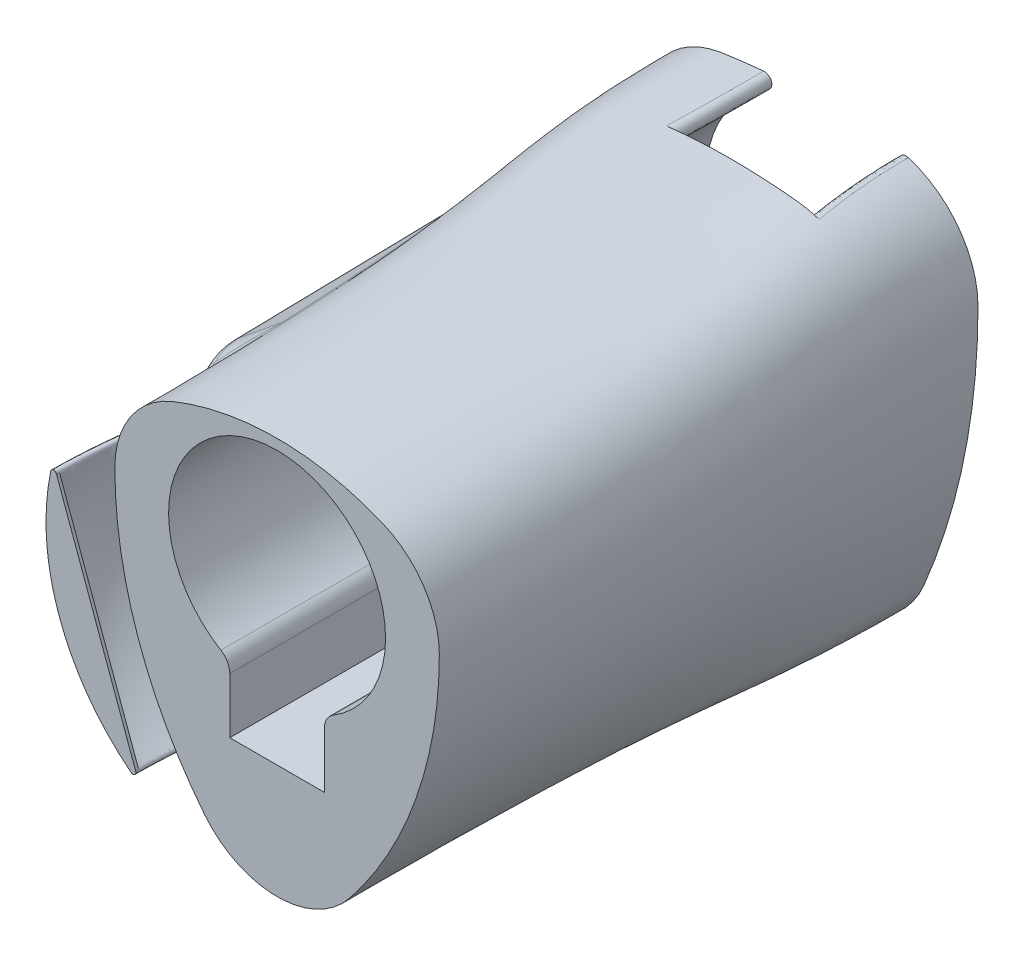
SolidWorks part; units mm, degrees
ref_plane "Front Plane" through (0, 0, 0) normal (0, 0, 1) x (1, 0, 0)
ref_plane "Top Plane" through (0, 0, 0) normal (0, 1, 0) x (1, 0, 0)
ref_plane "Right Plane" through (0, 0, 0) normal (1, 0, 0) x (0, 0, -1)
sketch "Sketch1" plane through (0, 0, 0) normal (0, 0, 1) x (1, 0, 0)
  line L0 (-25.4, 3.7252) -> (19.05, 3.7252) construction
  arc A0 (-9.1579, -36.6222) -> (11.711, -32.7366) centre (0, -27.8232) ccw construction
  arc A1 (11.711, -32.7366) -> (19.05, 3.7252) centre (-75.1948, 3.7252) ccw construction
  arc A2 (-9.1579, -36.6222) -> (-25.4, 3.7252) centre (32.8349, 3.7252) cw construction
  arc A3 (-25.4, 3.7252) -> (-15.285, 15.4959) centre (-13.4938, 3.7252) cw construction
  arc A4 (19.05, 3.7252) -> (7.2571, 16.3927) centre (6.35, 3.7252) ccw construction
  arc A5 (-15.285, 15.4959) -> (7.2571, 16.3927) centre (0, -84.9478) cw construction
  circle A6 centre (0, 0) radius 14.605 construction
  arc A7 (-26.162, 3.7252) -> (-15.3996, 16.2492) centre (-13.4938, 3.7252) cw
  arc A8 (-15.3996, 16.2492) -> (7.3116, 17.1528) centre (0, -84.9478) cw
  arc A9 (19.812, 3.7252) -> (7.3116, 17.1528) centre (6.35, 3.7252) ccw
  arc A10 (12.4137, -33.0314) -> (19.812, 3.7252) centre (-75.1948, 3.7252) ccw
  arc A11 (-9.7074, -37.1501) -> (12.4137, -33.0314) centre (0, -27.8232) ccw
  arc A12 (-9.7074, -37.1501) -> (-26.162, 3.7252) centre (32.8349, 3.7252) cw
  dimension "D1" = 101.6
  dimension "D2" = 12.7
  dimension "D6" = 12.7
  dimension "D7" = 29.21
  dimension "D3" = 25.4
  dimension "D4" = 19.05
  dimension "D5" = 57.1246
  dimension "D8" = 84.9478
  dimension "D9" = 0.762
ref_plane "End Plane" through (0, 0, 76.2) normal (0, 0, 1) x (1, 0, 0)
sketch "Sketch4" plane through (0, 0, 76.2) normal (0, 0, 1) x (1, 0, 0)
  line L0 (0, 16.1695) -> (0, -8.8103) construction
  line L1 (-22.225, 1.7278) -> (-22.225, 11.2362) construction
  arc A0 (-14.2875, 13.501) -> (14.2875, 13.501) centre (0, -21.8186) cw
  arc A1 (-14.2875, 13.501) -> (-22.225, 1.7278) centre (-9.525, 1.7278) ccw
  arc A2 (14.2875, 13.501) -> (22.225, 1.7278) centre (9.525, 1.7278) cw
  arc A3 (-22.225, 1.7278) -> (-9.9123, -33.3395) centre (33.8684, 1.7278) ccw
  arc A4 (22.225, 1.7278) -> (9.9123, -33.3395) centre (-33.8684, 1.7278) cw
  circle A6 centre (0, 0) radius 14.605 construction
  arc A7 (-9.9123, -33.3395) -> (9.9123, -33.3395) centre (0, -25.4) ccw
  point P12 (0, 16.2814)
  point P33 (0, 14.605)
  dimension "D1" = 12.7
  dimension "D3" = 38.1
  dimension "D2" = 1.6764
  dimension "D4" = 44.45
  dimension "D5" = 25.4
loft "Loft4" add profiles "Sketch1", "Sketch4"
ref_plane "Plane4" through (0, 0, 38.1) normal (0, 0, 1) x (1, 0, 0)
sketch "Sketch10" plane through (0, 0, 38.1) normal (0, 0, 1) x (1, 0, 0)
  line L0 (-19.1984, 0.9476) -> (-8.3393, -28.8876) construction
  line L1 (-17.7066, 1.4906) -> (-6.8475, -28.3447)
  line L2 (-20.6902, 0.4047) -> (-9.831, -29.4306)
  line L3 (-15.1563, -5.5164) -> (-13.7242, -4.9952) construction
  line L4 (-25.4, 3.7252) -> (19.05, 3.7252) construction
  arc A0 (-17.7066, 1.4906) -> (-20.6902, 0.4047) centre (-19.1984, 0.9476) ccw
  arc A1 (-9.831, -29.4306) -> (-6.8475, -28.3447) centre (-8.3393, -28.8876) ccw
  circle A2 centre (0, 0) radius 14.605 construction
  spline S0 degree 3 number of poles 127 (-14.6039, 14.283) -> (-14.6039, 14.283)
  spline S1 degree 3 number of poles 127 (-14.6039, 14.283) -> (-14.6039, 14.283) construction
  point P3 (-13.7688, -13.97)
  dimension "D1" = 31.75
  dimension "D2" = 3.175
  dimension "D3" = 1.524
  dimension "D4" = 70
  dimension "D5" = 13.97
ref_plane "Plane5" through (-13.7688, -13.97, 38.1) normal (0.342, -0.9397, 0) x (-0.9397, -0.342, 0)
sketch "Sketch11" plane through (-13.7688, -13.97, 38.1) normal (0.342, -0.9397, 0) x (-0.9397, -0.342, 0)
  circle A0 centre (25.4, 0) radius 25.4
  dimension "D1" = 50.8
ref_plane "Plane6" through (-19.3665, -7.0488, 0.7197) normal (-0.9391, -0.3418, 0.0349) x (0.342, -0.9397, 0)
ref_plane "Plane7" through (-25.8069, -9.393, 0.959) normal (-0.9391, -0.3418, 0.0349) x (0.342, -0.9397, 0)
sketch "Sketch13" plane through (-25.8069, -9.393, 0.959) normal (-0.9391, -0.3418, 0.0349) x (0.342, -0.9397, 0)
  line L1 (-6.1867, 61.5885) -> (23.0233, 61.5885)
  line L2 (-12.5367, 55.2385) -> (-12.5367, 17.1385)
  line L3 (-6.1867, 10.7885) -> (23.0233, 10.7885)
  line L4 (29.3733, 55.2385) -> (29.3733, 17.1385)
  line L5 (-7.4567, 37.4585) -> (24.2933, 37.4585) construction
  arc A0 (-6.1867, 10.7885) -> (-12.5367, 17.1385) centre (-6.1867, 17.1385) cw
  arc A1 (23.0233, 10.7885) -> (29.3733, 17.1385) centre (23.0233, 17.1385) ccw
  arc A2 (23.0233, 61.5885) -> (29.3733, 55.2385) centre (23.0233, 55.2385) cw
  arc A3 (-6.1867, 61.5885) -> (-12.5367, 55.2385) centre (-6.1867, 55.2385) ccw
  point P4 (-12.5367, 36.1885)
  point P13 (-12.5367, 10.7885)
  point P20 (-12.5367, 61.5885)
  dimension "D4" = 6.35
  dimension "D1" = 5.08
  dimension "D2" = 5.08
  dimension "D3" = 50.8
  dimension "D5" = 1.27
extrude "Boss-Extrude3" add sketch "Sketch13" against normal up to body draft 19 separate body
sweep "Cut-Sweep3" cut profiles "Sketch10" path "Sketch11"
fillet "Fillet17" radius 12.7 6 edges at (-10.7208, -35.6171, 13.6969) (-8.2115, -36.5143, 31.5173) (-9.7964, -33.5869, 62.0175) (-20.1117, 9.0919, 58.7027) (-23.2951, 7.4937, 28.1965) (-25.785, 2.4872, 12.1847)
fillet "Fillet21" radius 5.08 10 edges at (-15.2653, -36.7168, 17.0115) (-16.2873, -34.3283, 12.9041) (-22.5739, -17.1748, 11.741) (-28.7699, -0.0358, 12.8729) (-29.5351, 2.4836, 16.9579) (-28.908, 2.8197, 37.1255) (-26.7707, -0.5124, 62.0027) (-20.9079, -16.5684, 62.51) (-14.873, -33.2327, 61.6921) (-14.5739, -36.5629, 37.1255)
fillet "Fillet20" radius 1.27 22 edges at (-15.8496, -30.8952, 58.3065) (-27.9738, -1.4431, 20.5133) (-15.7866, -33.1523, 37.8953) (-28.3227, -0.6847, 18.5318) (-26.8505, -0.6949, 57.9618) (-27.0504, -0.2588, 56.8667) (-15.1462, -32.9324, 57.2088) (-22.4173, -17.1178, 16.513) (-28.0929, -1.5001, 16.7498) (-22.2772, -17.0668, 20.7837) (-17.4666, -30.5414, 18.26) (-21.0394, -16.6163, 58.5046) (-26.8814, -0.9677, 54.5637) (-21.1795, -16.6673, 54.234) (-15.4168, -32.0786, 58.3646)
sketch "Sketch16" plane through (0, 0, 0) normal (0, 0, -1) x (-1, 0, 0)
  line L0 (-6.477, -14.8802) -> (-6.477, -22.479)
  line L1 (-6.477, -22.479) -> (6.477, -22.479)
  line L2 (6.477, -22.479) -> (6.477, -14.8802)
  line L3 (0, -22.479) -> (0, 0) construction
  arc A0 (7.7006, -12.7079) -> (-7.7006, -12.7079) centre (0, 0) ccw
  arc A1 (6.477, -14.8802) -> (7.7006, -12.7079) centre (9.017, -14.8802) cw
  arc A2 (-6.477, -14.8802) -> (-7.7006, -12.7079) centre (-9.017, -14.8802) ccw
  dimension "D1" = 2.54
  dimension "D2" = 14.859
  dimension "D3" = 12.954
  dimension "D4" = 37.084
extrude "Cut-Extrude3" cut sketch "Sketch16" against normal through all
sketch "Sketch17" plane through (0, 0, 0) normal (0, 0, -1) x (-1, 0, 0)
  circle A0 centre (0, 0) radius 17.526
  dimension "D1" = 35.052
extrude "Cut-Extrude4" cut sketch "Sketch17" against normal blind 12.954
sketch "Sketch18" plane through (0, 0, 0) normal (0, 0, -1) x (-1, 0, 0)
  line L0 (-17.024, -4.1646) -> (-11.1026, -28.37)
  line L1 (11.1026, -28.37) -> (17.024, -4.1646)
  arc A0 (-17.024, -4.1646) -> (17.024, -4.1646) centre (0, 0) cw
  arc A1 (-11.1026, -28.37) -> (11.1026, -28.37) centre (0, -25.654) ccw
  arc A2 (6.477, -16.2852) -> (3.1833, 17.2345) centre (0, 0) ccw construction
  point P7 (0, 17.526)
  point P12 (0, -37.084)
  dimension "D1" = 54.61
  dimension "D2" = 11.43
extrude "Cut-Extrude5" cut sketch "Sketch18" against normal blind 3.81
sketch "Sketch19" plane through (-25.8069, -9.393, 0.959) normal (-0.9391, -0.3418, 0.0349) x (0.0312, 0.0162, 0.9994)
  text T0 "HOFFMAN  TACTICAL  AR-15  GEN 2" font "Arial Rounded MT Bold" height 3.5
extrude "Cut-Extrude6" cut sketch "Sketch19" against normal blind 0.508
fillet "Fillet22" radius 1.016 2 edges at (2.2399, 17.3823, 2.6456)
ref_plane "Plane8" through (0, 0, 52.014) normal (0, 0, 1) x (1, 0, 0)
ref_plane "Plane9" through (0, 0, 52.268) normal (0, 0, 1) x (1, 0, 0)
sketch "Sketch20" plane through (0, 0, 52.014) normal (0, 0, 1) x (1, 0, 0)
  line L0 (-25.5295, -1.3567) -> (-14.6703, -31.1919) construction
  line L1 (-25.1476, -1.2177) -> (-14.2884, -31.0529)
  line L2 (-25.9114, -1.4957) -> (-15.0522, -31.3309)
  arc A0 (-25.1476, -1.2177) -> (-25.9114, -1.4957) centre (-25.5295, -1.3567) ccw
  arc A1 (-15.0522, -31.3309) -> (-14.2884, -31.0529) centre (-14.6703, -31.1919) ccw
  point P2 (-20.0999, -16.2743)
  point P7 (0, 0)
  point P8 (-16.5464, -31.6753)
  point P12 (0, 0)
  dimension "D1" = 0.8128
sketch "Sketch22" plane through (0, 0, 52.268) normal (0, 0, 1) x (1, 0, 0)
  line L2 (-14.2884, -31.0529) -> (-25.1476, -1.2177)
  line L3 (-25.9114, -1.4957) -> (-15.0522, -31.3309)
  line L4 (-14.2884, -31.0529) -> (-25.1476, -1.2177)
  line L5 (-25.9114, -1.4957) -> (-15.0522, -31.3309)
  arc A2 (-15.0522, -31.3309) -> (-14.2884, -31.0529) centre (-14.6703, -31.1919) ccw
  arc A3 (-25.1476, -1.2177) -> (-25.9114, -1.4957) centre (-25.5295, -1.3567) ccw
  arc A4 (-15.0522, -31.3309) -> (-14.2884, -31.0529) centre (-14.6703, -31.1919) ccw
  arc A5 (-25.1476, -1.2177) -> (-25.9114, -1.4957) centre (-25.5295, -1.3567) ccw
  dimension "D1" = 0
sketch "Sketch21" plane through (0, 0, 76.2) normal (0, 0, 1) x (1, 0, 0)
  line L0 (-20.0999, -16.2743) -> (-29.0505, -19.5321) construction
  line L1 (-25.5295, -1.3567) -> (-14.6703, -31.1919) construction
  arc A0 (-19.9957, -33.3585) -> (-31.0016, -3.1201) centre (-1.1724, -9.3853) cw
  arc A1 (-19.4937, -32.7192) -> (-30.2061, -3.2872) centre (-1.1724, -9.3853) cw
  arc A2 (-19.9957, -33.3585) -> (-19.4937, -32.7192) centre (-19.7447, -33.0389) ccw
  arc A3 (-31.0016, -3.1201) -> (-30.2061, -3.2872) centre (-30.6038, -3.2036) cw
  dimension "D1" = 0.8128
  dimension "D3" = 30.48
  dimension "D2" = 31.75
  dimension "D4" = 9.525
loft "Loft6" add profiles "Sketch21", "Sketch22"
sketch "Sketch23" plane through (0, 0, 76.2) normal (0, 0, 1) x (1, 0, 0)
  line L0 (-30.2219, -3.0646) -> (-19.3628, -32.8999)
  arc A4 (-19.9957, -33.3585) -> (-19.4937, -32.7192) centre (-19.7447, -33.0389) ccw
  arc A5 (-30.2061, -3.2872) -> (-19.4937, -32.7192) centre (-1.1724, -9.3853) ccw
  arc A6 (-30.2061, -3.2872) -> (-31.0016, -3.1201) centre (-30.6038, -3.2036) ccw
  arc A7 (-31.0016, -3.1201) -> (-19.9957, -33.3585) centre (-1.1724, -9.3853) ccw
  arc A8 (-19.9957, -33.3585) -> (-19.3628, -32.8999) centre (-19.7447, -33.0389) ccw
  arc A10 (-30.2219, -3.0646) -> (-31.0016, -3.1201) centre (-30.6038, -3.2036) ccw
  arc A11 (-31.0016, -3.1201) -> (-19.9957, -33.3585) centre (-1.1724, -9.3853) ccw
  dimension "D1" = 0
extrude "Boss-Extrude4" add sketch "Sketch23" against normal blind 0.4064
